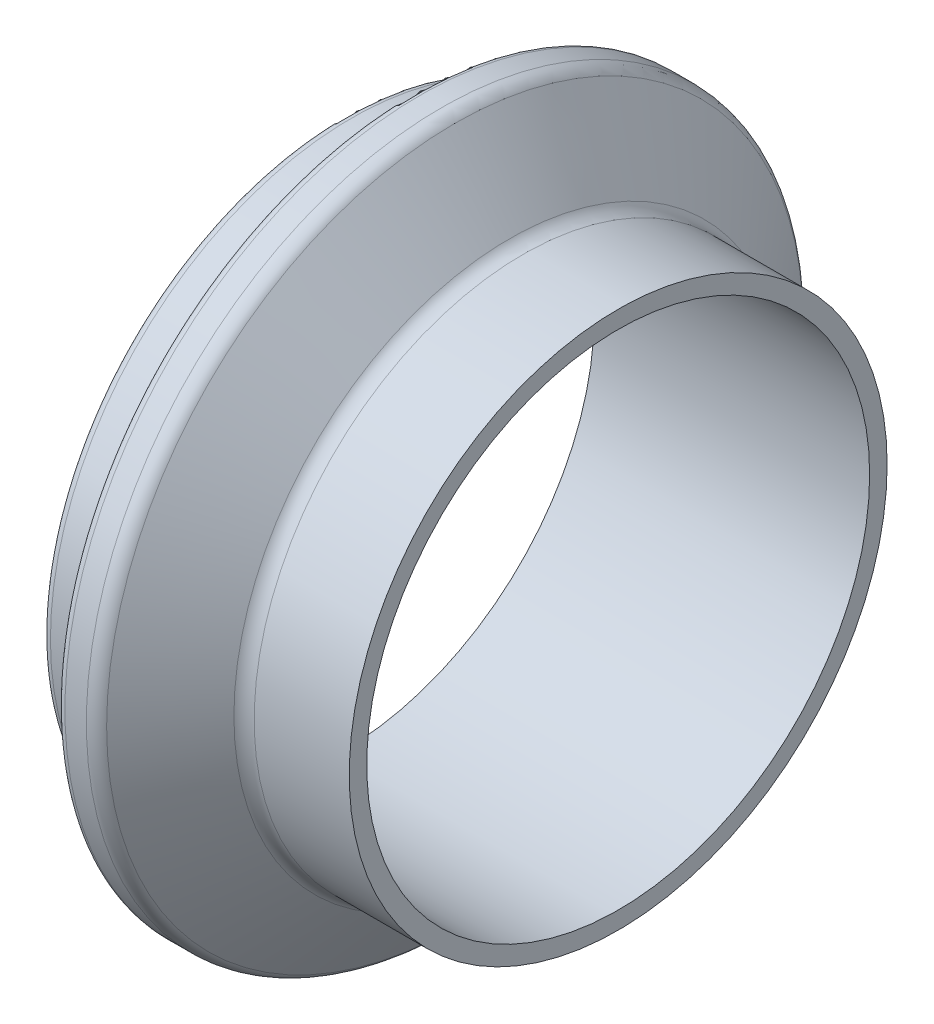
SolidWorks part; units mm, degrees
ref_plane "Front Plane" through (0, 0, 0) normal (0, 0, 1) x (1, 0, 0)
ref_plane "Top Plane" through (0, 0, 0) normal (0, 1, 0) x (1, 0, 0)
ref_plane "Right Plane" through (0, 0, 0) normal (1, 0, 0) x (0, 0, -1)
sketch "Sketch1" plane through (0, 0, 0) normal (0, 0, 1) x (1, 0, 0)
  line L0 (0, 0) -> (-37.0343, 0) construction
  line L1 (0, 23.749) -> (-26.0096, 23.749)
  line L2 (-26.0096, 23.749) -> (-26.0096, 27.6098)
  line L3 (-25.1968, 28.4226) -> (-20.3454, 28.4226)
  line L4 (-19.5326, 29.2354) -> (-19.5326, 32.7152)
  line L5 (-18.7198, 33.528) -> (-16.6982, 33.528)
  line L6 (-15.4203, 32.8908) -> (-10.2557, 26.0372)
  line L7 (-8.9777, 25.4) -> (0, 25.4)
  line L8 (0, 25.4) -> (0, 23.749)
  arc A0 (-18.7198, 33.528) -> (-19.5326, 32.7152) centre (-18.7198, 32.7152) ccw
  arc A1 (-19.5326, 29.2354) -> (-20.3454, 28.4226) centre (-20.3454, 29.2354) cw
  arc A2 (-25.1968, 28.4226) -> (-26.0096, 27.6098) centre (-25.1968, 27.6098) ccw
  arc A3 (-8.9777, 25.4) -> (-10.2557, 26.0372) centre (-8.9777, 27.0002) cw
  arc A4 (-15.4203, 32.8908) -> (-16.6982, 33.528) centre (-16.6982, 31.9278) ccw
  point P13 (-19.5326, 33.528)
  point P18 (-26.0096, 28.4226)
  point P23 (-15.9004, 33.528)
  dimension "D7" = 0.8128
  dimension "D8" = 1.6002
  dimension "D1" = 23.749
  dimension "D2" = 25.4
  dimension "D3" = 33.528
  dimension "D4" = 28.4226
  dimension "D5" = 3.6322
  dimension "D6" = 6.477
  dimension "D9" = 26.0096
revolve "Revolve1" add sketch "Sketch1" angle 360 about L0
